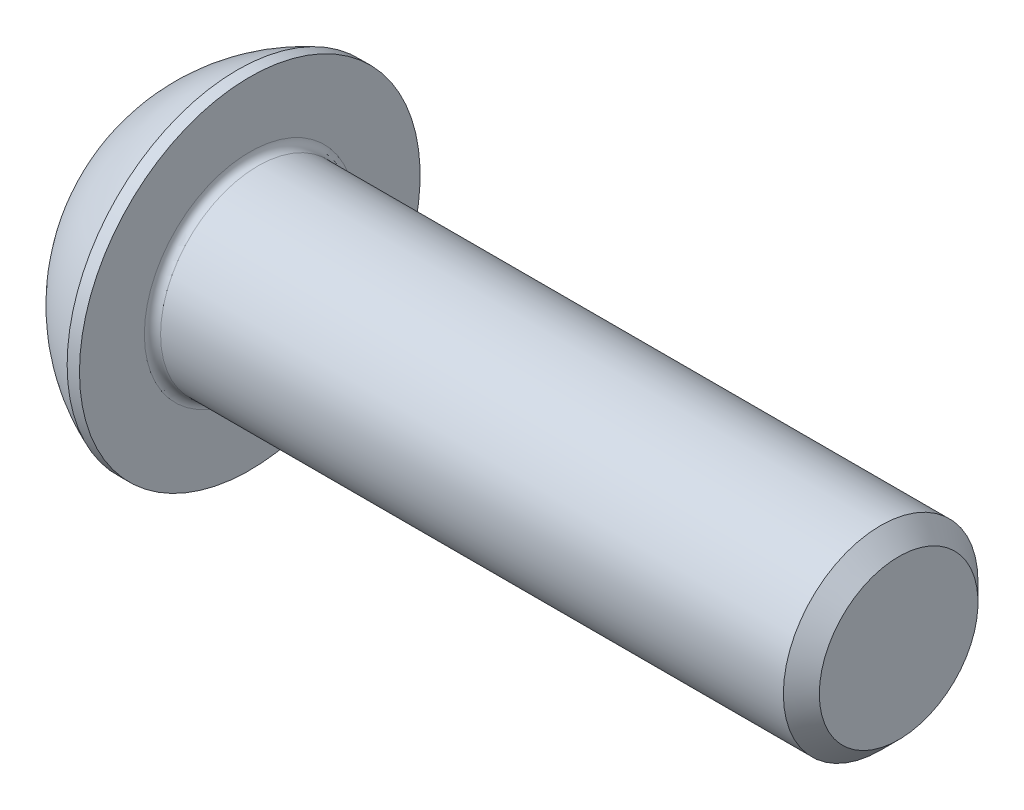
SolidWorks part; units mm, degrees
ref_plane "Plane1" through (0, 0, 0) normal (0, 0, 1) x (1, 0, 0)
ref_plane "Plane2" through (0, 0, 0) normal (0, 1, 0) x (1, 0, 0)
ref_plane "Plane3" through (0, 0, 0) normal (1, 0, 0) x (0, 0, -1)
sketch "BodySke" plane through (0, 0, 0) normal (0, 0, 1) x (1, 0, 0)
  line L0 (23.3, 0) -> (23.3, 2.4455)
  line L1 (22.7455, 3) -> (3.3, 3)
  line L2 (3.3, 3) -> (3.3, 5.25)
  line L3 (3.3, 5.25) -> (2.92, 5.25)
  line L4 (0, 0) -> (101.6, 0) construction
  line L5 (3.3, -5.25) -> (2.92, -5.25) construction
  line L6 (55.6768, -3) -> (3.3, -3) construction
  line L7 (23.3, 0) -> (0, 0)
  line L8 (0, 2.625) -> (0, -2.625) construction
  line L9 (0, 0) -> (0, 2.625)
  line L10 (23.3, 2.4455) -> (22.7455, 3)
  line L11 (23.3, -2.4455) -> (22.7455, -3) construction
  line L12 (4.3, 9.525) -> (4.3, -3) construction
  line L13 (3.3, 9.525) -> (3.3, -3) construction
  arc A1 (0, 2.625) -> (2.92, 5.25) centre (4.9997, 0) cw
revolve "BaseBody" add sketch "BodySke" angle 360 about L4
fillet "Fillet1" radius 0.25 1 edges at (3.3, 0, 3)
sketch "Sketch2" plane through (0, 0, 0) normal (0, 0, 1) x (1, 0, 0)
  line L0 (0, 2) -> (2.08, 2)
  line L1 (2.08, 2) -> (3.2347, 0)
  line L3 (3.2347, 0) -> (0, 0)
  line L4 (0, 0) -> (0, 2)
  line L5 (0, -2) -> (2.08, -2) construction
  line L6 (0, 0) -> (47.625, 0) construction
  dimension "D2" = 60
  dimension "PreBroach_depth" = 2.08
  dimension "PreBroach_dia" = 4
revolve "PreBroach" cut sketch "Sketch2" angle 360 about L6
sketch "Sketch3" plane through (0, 0, 0) normal (1, 0, 0) x (0, 0, -1)
  line L0 (-2, -1.1547) -> (-2, 1.1547)
  line L1 (-2, 1.1547) -> (0, 2.3094)
  line L2 (0, 2.3094) -> (2, 1.1547)
  line L3 (2, 1.1547) -> (2, -1.1547)
  line L4 (2, -1.1547) -> (0, -2.3094)
  line L5 (0, -2.3094) -> (-2, -1.1547)
extrude "Hex" cut sketch "Sketch3" along normal blind 2.08
sketch "ThdSchSke" plane through (0, 0, 0) normal (0, 0, 1) x (1, 0, 0)
  line L0 (5.3, -2.4455) -> (4.9117, -3)
  line L1 (5.3, -2.4455) -> (5.6883, -3)
  line L2 (5.6883, -3) -> (5.6883, -3.75)
  line L3 (-3.175, 0) -> (5.1513, 0) construction
  line L5 (5.6883, -3.75) -> (4.9117, -3.75)
  line L6 (4.9117, -3.75) -> (4.9117, -3)
revolve "ThreadSchematic" [suppressed] cut sketch "ThdSchSke" angle 360 about L3
pattern_linear "ThdSchPat" [suppressed]
equation "\"D1@BodySke\" = \"Head_dia@BodySke\" * .5"
equation "\"Thread_minor@ThreadCosmetic\" = \"Minor_dia@BodySke\""
equation "\"D1@Sketch3\" = \"Hex_size@Sketch3\" / 2"
equation "\"D2@Sketch3\" = \"D1@Sketch3\""
equation "\"D3@Sketch3\" = \"Hex_size@Sketch3\""
equation "\"Thread_length@ThreadCosmetic\" = ((sgn( (\"Length@BodySke\" - \"Advance@BodySke\" * 2.0) - \"Thread_nom@BodySke\" )-1)*( (\"Length@BodySke\" - \"Advance@BodySke\" * 2.0) - \"Thread_nom@BodySke\" ))/-2+ \"Thread_no"
equation "\"Thread_minor@ThdSchSke\" = \"Minor_dia@BodySke\""
equation "\"Diameter@ThdSchSke\" = \"Diameter@BodySke\""
equation "\"Overcut@ThdSchSke\" = \"Diameter@BodySke\" * 1.25"
equation "\"Start@ThdSchSke\" = \"Head_ht@BodySke\" + \"Length@BodySke\" - \"Thread_length@ThreadCosmetic\"  '---Non-countersunk---"
equation "\"Num_threads@ThdSchPat\" = int( \"Thread_length@ThreadCosmetic\" / \"Advance@BodySke\" + 0.999 )  + 1"
equation "\"Advance@ThdSchPat\" = \"Thread_length@ThreadCosmetic\" /  (\"Num_threads@ThdSchPat\" - 1) 'relax it"
equation "\"Num_threads@ThdSchPat\" = \"Num_threads@ThdSchPat\" - sgn( \"Num_threads@ThdSchPat\" - 1) '---chamfered tips only---"
